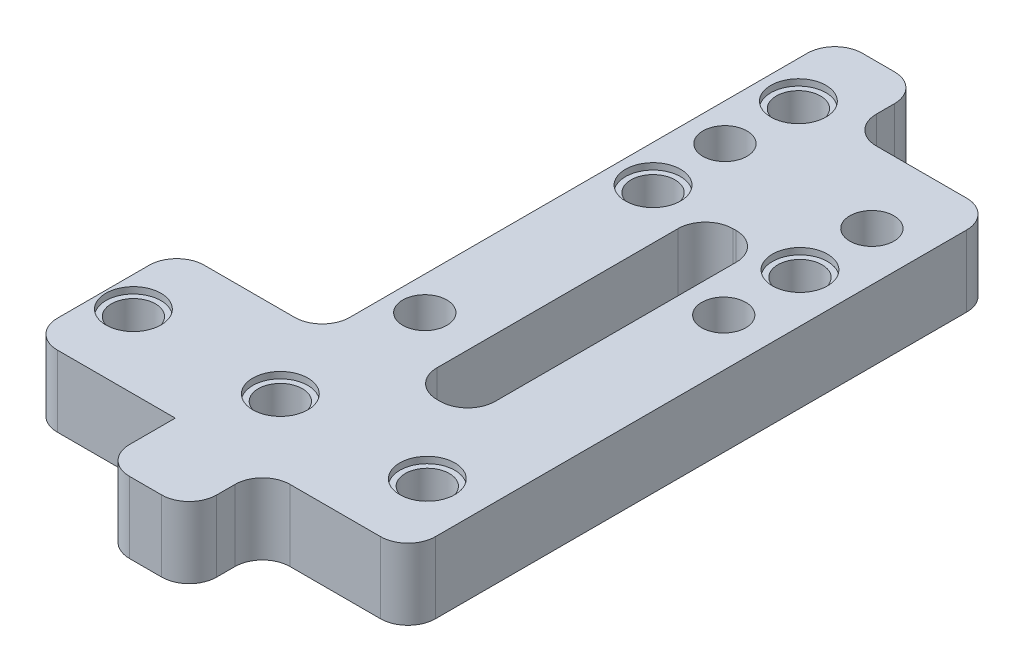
SolidWorks part; units mm, degrees
ref_plane "Front Plane" through (0, 0, 0) normal (0, 0, 1) x (1, 0, 0)
ref_plane "Top Plane" through (0, 0, 0) normal (0, 1, 0) x (1, 0, 0)
ref_plane "Right Plane" through (0, 0, 0) normal (1, 0, 0) x (0, 0, -1)
sketch "Sketch1" plane through (0, 0, 0) normal (0, 1, 0) x (1, 0, 0)
  line L0 (0, 0) -> (15.841, 0)
  line L1 (15.841, 0) -> (15.841, -7.985)
  line L2 (15.841, -7.985) -> (25.341, -7.985)
  line L3 (25.341, -7.985) -> (25.341, 0)
  line L4 (25.341, 0) -> (41.182, 0)
  line L5 (41.182, 0) -> (41.182, 63.83)
  line L6 (41.182, 63.83) -> (25.341, 63.83)
  line L7 (25.341, 63.83) -> (25.341, 71.815)
  line L8 (25.341, 71.815) -> (15.841, 71.815)
  line L9 (15.841, 71.815) -> (15.841, 16)
  line L10 (15.841, 16) -> (0, 16)
  line L11 (0, 16) -> (0, 0)
  dimension "D1" = 16
  dimension "D2" = 9.5
  dimension "D3" = 9.5
  dimension "D4" = 7.985
  dimension "D5" = 15.841
  dimension "D6" = 79.8
  dimension "D7" = 63.83
  dimension "D8" = 15.841
extrude "Boss-Extrude1" add sketch "Sketch1" along normal blind 7.75
sketch "Sketch2" plane through (0, 7.75, 0) normal (0, 1, 0) x (1, 0, 0)
  line L0 (25.341, 48.23) -> (31.681, 48.23)
  line L1 (31.681, 48.23) -> (31.681, 16)
  line L2 (31.681, 16) -> (25.341, 16)
  line L3 (25.341, 48.23) -> (25.341, 16)
  line L4 (15.841, 71.815) -> (15.841, 16) construction
  line L5 (25.341, 0) -> (41.182, 0) construction
  dimension "D1" = 6.34
  dimension "D2" = 9.5
  dimension "D3" = 32.23
  dimension "D4" = 16
extrude "Cut-Extrude1" cut sketch "Sketch2" against normal through all
sketch "Sketch3" plane through (0, 7.75, 0) normal (0, 1, 0) x (-1, 0, 0)
  line L0 (0, -8) -> (-44.5338, -8) construction
  line L1 (0, -16) -> (0, 0) construction
  line L2 (-9.8115, -55.81) -> (-51.1673, -55.81) construction
  line L3 (0, 0) -> (-15.841, 0) construction
  line L4 (-35.282, -72.908) -> (-35.282, 6.0722) construction
  line L5 (-41.182, 0) -> (-41.182, -63.83) construction
  line L6 (-19.282, -5.6) -> (-19.282, -75.0846) construction
  circle A0 centre (-3.282, -8) radius 2.4
  circle A1 centre (-35.282, -8) radius 2.4
  circle A2 centre (-19.282, -8) radius 2.4
  circle A3 centre (-19.882, -55.81) radius 2.4
  circle A4 centre (-35.882, -55.81) radius 2.4
  dimension "D4" = 16
  dimension "D5" = 16
  dimension "D6" = 0.6
  dimension "D7" = 16
  dimension "D8" = 4.8
  dimension "D9" = 4.8
  dimension "D1" = 8
  dimension "D2" = 47.81
  dimension "D3" = 5.9
extrude "Cut-Extrude2" cut sketch "Sketch3" against normal through all
sketch "Sketch4" plane through (0, 7.75, 0) normal (0, 1, 0) x (-1, 0, 0)
  circle A2 centre (-35.282, -8) radius 3
  circle A3 centre (-19.282, -8) radius 3
  circle A4 centre (-3.282, -8) radius 3
extrude "Cut-Extrude3" cut sketch "Sketch4" against normal blind 0.7
sketch "Sketch5" plane through (0, 0, 0) normal (0, -1, 0) x (1, 0, 0)
  circle A0 centre (3.282, -8) radius 3
  circle A1 centre (19.282, -8) radius 3
  circle A2 centre (35.282, -8) radius 3
extrude "Cut-Extrude4" cut sketch "Sketch5" against normal blind 0.7
fillet "Fillet2" radius 3 15 edges at (41.182, 3.875, 0) (41.182, 3.875, -63.83) (25.341, 3.875, -63.83) (31.681, 3.875, -48.23) (25.341, 3.875, -48.23) (25.341, 3.875, -16) (25.341, 3.875, 0) (25.341, 3.875, 7.985) (15.841, 3.875, 7.985) (0, 3.875, 0) (0, 3.875, -16) (15.841, 3.875, -16) (31.681, 3.875, -16) (25.341, 3.875, -71.815) (15.841, 3.875, -71.815)
sketch "Sketch6" plane through (0, 7.75, 0) normal (0, 1, 0) x (1, 0, 0)
  line L0 (7.3084, 23.53) -> (28.9619, 23.53) construction
  line L1 (0, 8) -> (44.5338, 8) construction
  line L2 (19.282, 5.6) -> (19.282, 75.0846) construction
  circle A0 centre (19.482, 23.53) radius 2.4
  dimension "D2" = 4.8
  dimension "D1" = 15.53
  dimension "D3" = 0.2
extrude "Cut-Extrude5" cut sketch "Sketch6" against normal through all
sketch "Sketch7" plane through (0, 7.75, 0) normal (0, 1, 0) x (-1, 0, 0)
  line L0 (-28.5559, -39.58) -> (-45.9787, -39.58) construction
  line L1 (-9.8115, -55.81) -> (-51.1673, -55.81) construction
  line L2 (-35.282, -72.908) -> (-35.282, 6.0722) construction
  circle A0 centre (-35.982, -39.58) radius 2.4
  dimension "D2" = 4.8
  dimension "D1" = 16.23
  dimension "D3" = 0.7
extrude "Cut-Extrude6" cut sketch "Sketch7" against normal through all
sketch "Sketch8" plane through (0, 7.75, 0) normal (0, 1, 0) x (-1, 0, 0)
  line L0 (-11.6605, -47.98) -> (-48.1562, -47.98) construction
  line L1 (-11.6605, -63.81) -> (-52.5357, -63.81) construction
  line L2 (-19.882, -68.7534) -> (-19.882, -42.3047) construction
  line L3 (-15.841, -68.815) -> (-15.841, -19) construction
  circle A0 centre (-19.882, -55.81) radius 2.4 construction
  circle A1 centre (-19.882, -47.98) radius 2.4
  circle A2 centre (-19.882, -63.81) radius 2.4
  circle A3 centre (-35.882, -47.98) radius 2.4
  dimension "D2" = 7.83
  dimension "D3" = 4.8
  dimension "D4" = 4.8
  dimension "D5" = 4.8
  dimension "D6" = 16
  dimension "D7" = 4.041
  dimension "D1" = 15.83
extrude "Cut-Extrude7" cut sketch "Sketch8" against normal through all
sketch "Sketch9" plane through (0, 7.75, 0) normal (0, 1, 0) x (-1, 0, 0)
  circle A0 centre (-19.882, -63.81) radius 3
  circle A1 centre (-19.882, -47.98) radius 3
  circle A2 centre (-35.882, -47.98) radius 3
  dimension "D1" = 6
  dimension "D2" = 6
  dimension "D3" = 6
extrude "Cut-Extrude8" cut sketch "Sketch9" against normal blind 0.7
sketch "Sketch10" plane through (0, 0, 0) normal (0, -1, 0) x (1, 0, 0)
  circle A0 centre (19.882, -63.81) radius 3
  circle A1 centre (19.882, -47.98) radius 3
  circle A2 centre (35.882, -47.98) radius 3
  dimension "D1" = 6
  dimension "D2" = 6
  dimension "D3" = 6
extrude "Cut-Extrude9" cut sketch "Sketch10" against normal blind 0.7
